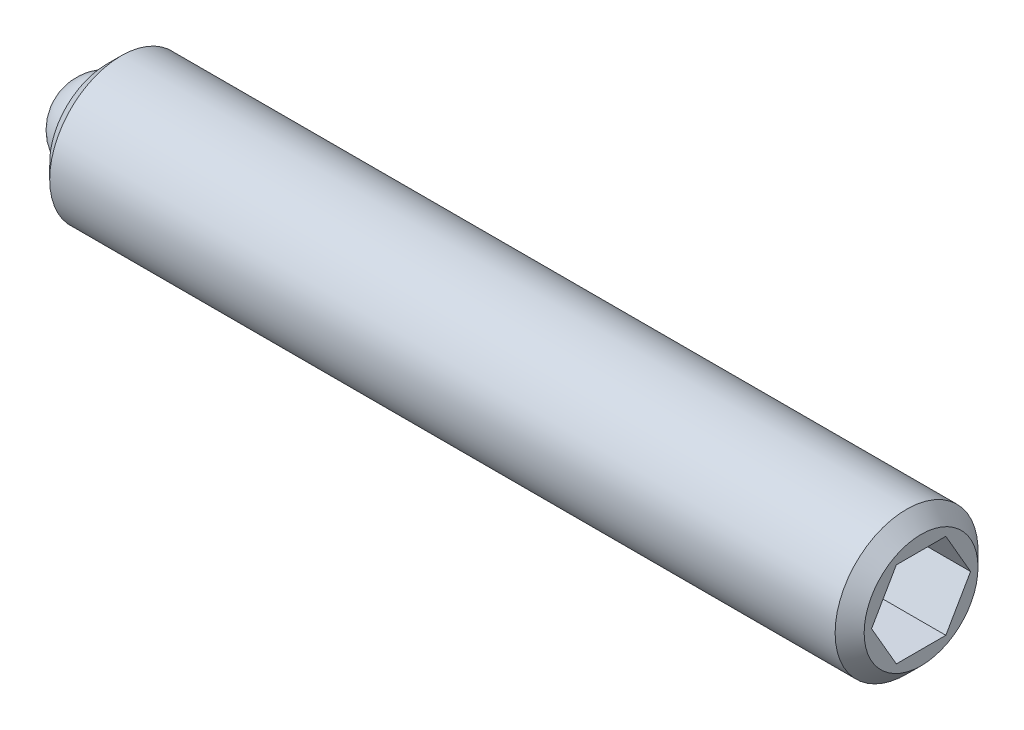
SolidWorks part; units mm, degrees
ref_plane "Front Plane" through (0, 0, 0) normal (0, 0, 1) x (1, 0, 0)
ref_plane "Top Plane" through (0, 0, 0) normal (0, 1, 0) x (1, 0, 0)
ref_plane "Right Plane" through (0, 0, 0) normal (1, 0, 0) x (0, 0, -1)
sketch "Sketch2" plane through (0, 0, 0) normal (1, 0, 0) x (0, 0, -1)
  circle A0 centre (0, 0) radius 1.25
  dimension "D1" = 2.5
extrude "Boss-Extrude1" add sketch "Sketch2" along normal blind 14.25
sketch "Sketch3" plane through (0, 0, 0) normal (-1, 0, 0) x (0, 0, 1)
  circle A0 centre (0, 0) radius 0.75
  dimension "D1" = 1.5
chamfer "Chamfer1" distance 0.254 angle 45 1 edges at (0, 0, -1.25)
chamfer "Chamfer2" distance 0.254 angle 45 1 edges at (14.25, 0, -1.25)
sketch "Sketch4" plane through (14.25, 0, 0) normal (1, 0, 0) x (0, 0, -1)
  line L1 (0.866, 0) -> (0.433, 0.75)
  line L2 (0.433, 0.75) -> (-0.433, 0.75)
  line L3 (-0.433, 0.75) -> (-0.866, 0)
  line L4 (-0.866, 0) -> (-0.433, -0.75)
  line L5 (-0.433, -0.75) -> (0.433, -0.75)
  line L6 (0.433, -0.75) -> (0.866, 0)
  circle A0 centre (0, 0) radius 0.75 construction
  dimension "D1" = 1.5
extrude "Cut-Extrude2" cut sketch "Sketch4" against normal blind 2
extrude "Cut-Extrude3" cut sketch "Sketch3" against normal blind 0.8
sketch "Sketch5" plane through (0, 0, 0) normal (-1, 0, 0) x (0, 0, 1)
  line L0 (0, 0) -> (0, -0.75)
  line L1 (0, 0) -> (0, 0.75)
  arc A0 (0, 0.75) -> (0, -0.75) centre (0, 0) ccw
  dimension "D1" = 0.75
revolve "Revolve1" add sketch "Sketch5" angle 360 about L1
